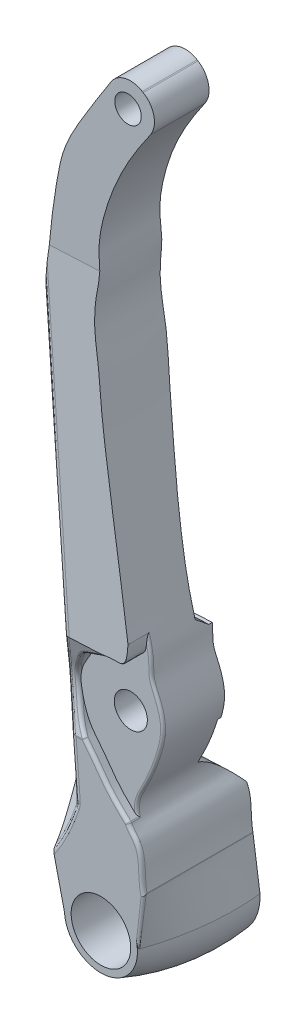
SolidWorks part; units mm, degrees
ref_plane "Plan1" through (0, 0, 0) normal (0, 0, 1) x (1, 0, 0)
ref_plane "Plan2" through (0, 0, 0) normal (0, 1, 0) x (1, 0, 0)
ref_plane "Plan3" through (0, 0, 0) normal (1, 0, 0) x (0, 0, -1)
mirrored part "levier1-"
sketch "Esquisse1" plane through (53.9341, 4.0573, -54.0865) normal (-0.7051, -0.053, 0.7071) x (0.7091, -0.0527, 0.7031)
  line L1 (40.1916, 284.1202) -> (34.293, 311.5659)
  line L2 (40.1916, 284.1202) -> (29.9615, 281.9215)
  line L3 (34.293, 311.5659) -> (24.0629, 309.3673)
  line L4 (29.9615, 281.9215) -> (24.0629, 309.3673)
  line L5 (46.2716, 255.8303) -> (57.6189, 203.0324) construction
extrude "Enlèv. mat.-Extru.2" cut sketch "Esquisse1" against normal blind 0.1
